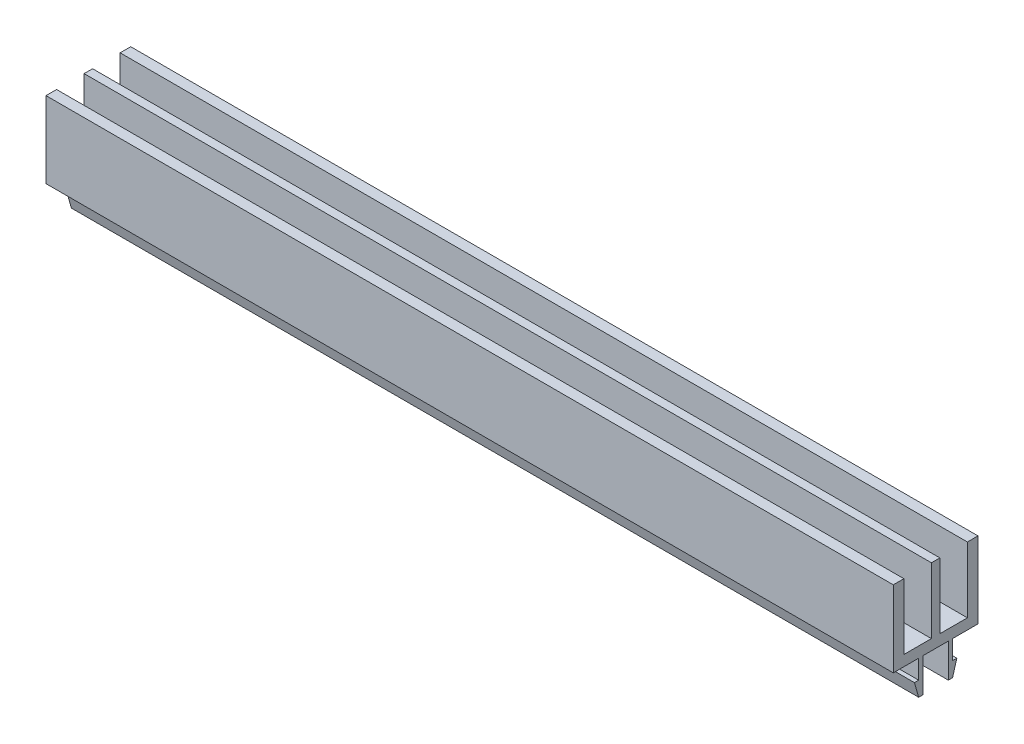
SolidWorks part; units mm, degrees
ref_plane "Front Plane" through (0, 0, 0) normal (0, 0, 1) x (1, 0, 0)
ref_plane "Top Plane" through (0, 0, 0) normal (0, 1, 0) x (1, 0, 0)
ref_plane "Right Plane" through (0, 0, 0) normal (1, 0, 0) x (0, 0, -1)
sketch3d "3DSketch1"
  line L0 (0, 0, 0) -> (200, 0, 0)
  dimension "D1" = 200
other "Paneeliliu'ut 1.6024 PANEELILIUKU 2(1)"
ref_plane "Plane1" through (0, 0, 0) normal (1, 0, 0) x (0, 0, -1)
sketch "Sketch1" plane through (0, 0, 0) normal (1, 0, 0) x (0, 0, -1)
  line L0 (4.6555, -4.41) -> (10.6555, -4.41)
  line L1 (10.6555, -4.41) -> (10.6555, 13.59)
  line L2 (10.6555, 13.59) -> (8.1555, 13.59)
  line L3 (8.1555, 13.59) -> (8.1555, -1.91)
  line L4 (8.1555, -1.91) -> (1.6555, -1.91)
  line L5 (1.6555, -1.91) -> (1.6555, 13.59)
  line L6 (1.6555, 13.59) -> (-0.3445, 13.59)
  line L7 (-0.3445, 13.59) -> (-0.3445, -1.91)
  line L8 (-0.3445, -1.91) -> (-6.8445, -1.91)
  line L9 (-6.8445, -1.91) -> (-6.8445, 13.59)
  line L10 (-6.8445, 13.59) -> (-9.3445, 13.59)
  line L11 (-9.3445, 13.59) -> (-9.3445, -4.41)
  line L12 (-9.3445, -4.41) -> (-3.3445, -4.41)
  line L13 (-3.3445, -4.41) -> (-3.3445, -8.91)
  line L14 (-3.3445, -8.91) -> (-4.3445, -8.91)
  line L15 (-4.3445, -8.91) -> (-3.3445, -12.41)
  line L16 (-3.3445, -12.41) -> (-2.3445, -12.41)
  line L17 (-2.3445, -12.41) -> (-2.3445, -4.41)
  line L18 (-2.3445, -4.41) -> (3.6555, -4.41)
  line L19 (3.6555, -4.41) -> (3.6555, -12.41)
  line L20 (3.6555, -12.41) -> (4.6555, -12.41)
  line L21 (4.6555, -12.41) -> (5.6555, -8.91)
  line L22 (5.6555, -8.91) -> (4.6555, -8.91)
  line L23 (4.6555, -8.91) -> (4.6555, -4.41)
  point P24 (0, 0)
